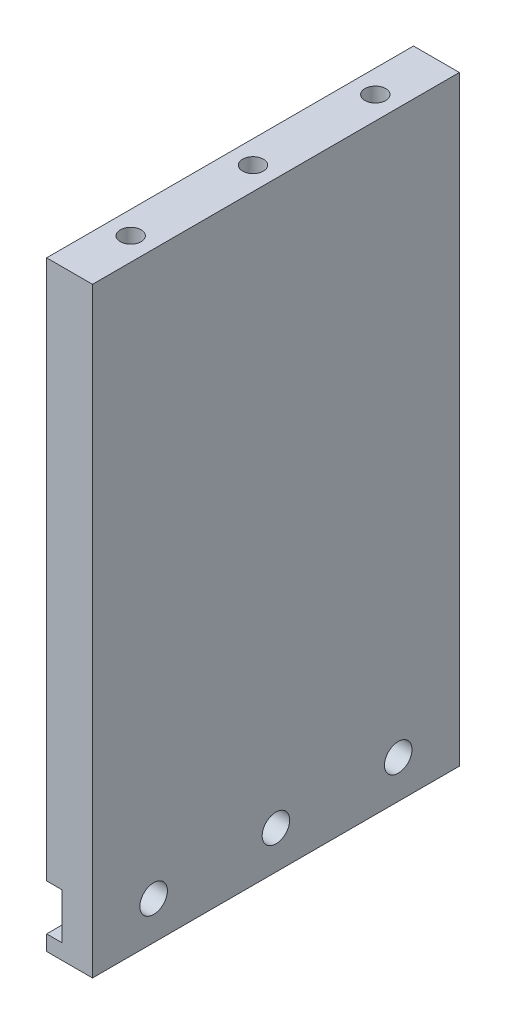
SolidWorks part; units mm, degrees
ref_plane "Face" through (0, 0, 0) normal (0, 0, 1) x (1, 0, 0)
ref_plane "Dessus" through (0, 0, 0) normal (0, 1, 0) x (1, 0, 0)
ref_plane "Droite" through (0, 0, 0) normal (1, 0, 0) x (0, 0, -1)
sketch "Esquisse1" plane through (0, 0, 0) normal (0, 0, 1) x (1, 0, 0)
  line L0 (-7.5, -96.5) -> (-7.5, -101.5)
  line L1 (-7.5, 95) -> (7.5, 95)
  line L2 (-7.5, 95) -> (-7.5, -81.5)
  line L3 (-7.5, -101.5) -> (7.5, -101.5)
  line L4 (7.5, 95) -> (7.5, -101.5)
  line L5 (-7.5, -81.5) -> (-2.5, -81.5)
  line L7 (-7.5, -96.5) -> (-2.5, -96.5)
  line L8 (-2.5, -81.5) -> (-2.5, -96.5)
  dimension "D1" = 15
  dimension "D2" = 7.5
  dimension "D3" = 196.5
  dimension "D4" = 95
  dimension "D5" = 15
  dimension "D6" = 5
  dimension "D7" = 5
extrude "Extrusion1" add sketch "Esquisse1" along normal mid plane 120
hole_wizard "Dégagement M81" positions "Esquisse3" profile "Esquisse2" hole size "M8" standard "Ansi Métrique"
sketch "Esquisse3" plane through (7.5, 0, 0) normal (1, 0, 0) x (0, 0, -1)
  line L0 (-60, -96.5) -> (60, -96.5) construction
  point P0 (0, -89)
  point P1 (40, -89)
  point P2 (-40, -89)
  dimension "D1" = 7.5
  dimension "D2" = 40
  dimension "D3" = 40
sketch "Esquisse2" plane through (7.5, -89, 0) normal (0, 1, 0) x (0, 0, -1)
  line L0 (0, 0) -> (0, 15)
  line L1 (0, 15) -> (4.5, 15)
  line L2 (4.5, 15) -> (4.5, 0)
  line L5 (4.5, 0) -> (0, 0)
  line L11 (0, -6.35) -> (0, 107.95) construction
  dimension "Diamètre du perçage jusqu'au prochain" = 9
  dimension "Profondeur du perçage jusqu'au prochain" = 15
hole_wizard "Trou taraudé M8x1.251" positions "Esquisse5" profile "Esquisse4" tap size "M8x1.25" standard "Ansi Métrique"
sketch "Esquisse5" plane through (0, 95, 0) normal (0, 1, 0) x (-1, 0, 0)
  point P0 (0, 0)
  point P1 (0, 40)
  point P2 (0, -40)
  dimension "D1" = 40
  dimension "D2" = 40
sketch "Esquisse4" plane through (0, 95, 0) normal (1, 0, 0) x (0, 0, 1)
  line L0 (0, 0) -> (0, 24.2929)
  line L1 (0, 24.2929) -> (3.4, 22.25)
  line L2 (3.4, 22.25) -> (3.4, 0)
  line L5 (3.4, 0) -> (0, 0)
  line L10 (0, 24.2929) -> (-3.4, 22.25) construction
  line L11 (0, -6.35) -> (0, 107.95) construction
  dimension "Diamètre du trou pour taraudage" = 6.8
  dimension "Profondeur du trou pour taraudage" = 22.25
  dimension "Angle de pointe" = 118
